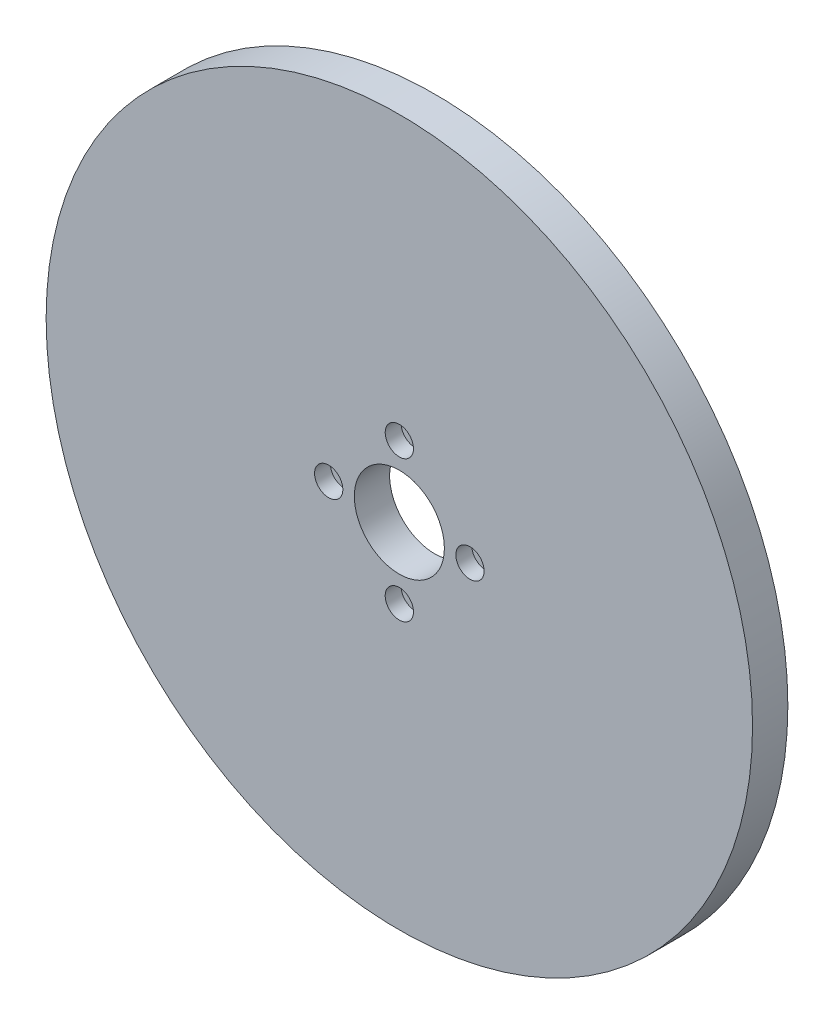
SolidWorks part; units mm, degrees
ref_plane "前视基准面" through (0, 0, 0) normal (0, 0, 1) x (1, 0, 0)
ref_plane "上视基准面" through (0, 0, 0) normal (0, 1, 0) x (1, 0, 0)
ref_plane "右视基准面" through (0, 0, 0) normal (1, 0, 0) x (0, 0, -1)
sketch "草图1" plane through (0, 0, 0) normal (0, 0, 1) x (1, 0, 0)
  circle A0 centre (0, 0) radius 100
  circle A1 centre (0, 0) radius 12.75
  circle A2 centre (20, 0) radius 2.25
  circle A3 centre (0, -20) radius 2.25
  circle A4 centre (-20, 0) radius 2.25
  circle A5 centre (0, 20) radius 2.25
extrude "凸台-拉伸1" add sketch "草图1" along normal blind 10
sketch "草图2" plane through (0, 0, 10) normal (0, 0, 1) x (1, 0, 0)
  circle A0 centre (20, 0) radius 4
  circle A1 centre (0, -20) radius 4
  circle A2 centre (-20, 0) radius 4
  circle A3 centre (0, 20) radius 4
extrude "切除-拉伸1" cut sketch "草图2" against normal blind 4.5
